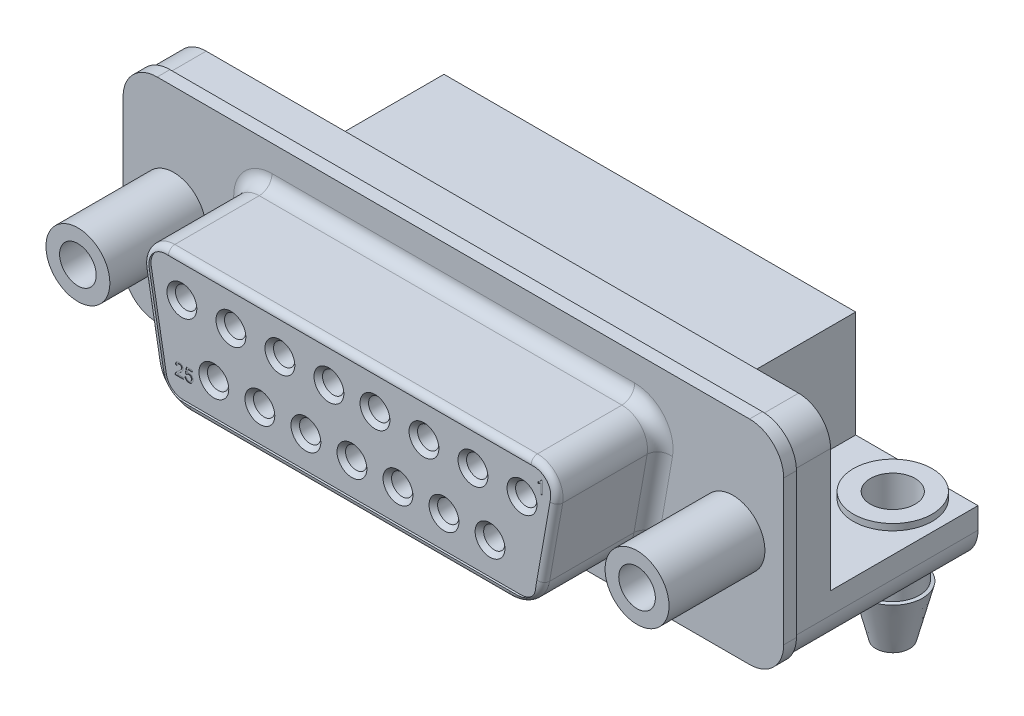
SolidWorks part; units mm, degrees
ref_plane "FRONT" through (0, 0, 0) normal (0, 0, 1) x (1, 0, 0)
ref_plane "TOP" through (0, 0, 0) normal (0, 1, 0) x (1, 0, 0)
ref_plane "RIGHT" through (0, 0, 0) normal (1, 0, 0) x (0, 0, -1)
sketch "Sketch1" plane through (0, 0, 0) normal (0, 0, 1) x (1, 0, 0)
  line L0 (19.685, 0) -> (-19.685, 0) construction
  line L1 (-17.653, -6.3373) -> (17.653, -6.3373)
  line L2 (-19.685, -4.3053) -> (-19.685, 4.3053)
  line L3 (-17.653, 6.3373) -> (17.653, 6.3373)
  line L4 (19.685, -4.3053) -> (19.685, 4.3053)
  line L5 (0, 6.3373) -> (0, -6.3373) construction
  arc A0 (-19.685, -4.3053) -> (-17.653, -6.3373) centre (-17.653, -4.3053) ccw
  arc A1 (-17.653, 6.3373) -> (-19.685, 4.3053) centre (-17.653, 4.3053) ccw
  arc A2 (19.685, 4.3053) -> (17.653, 6.3373) centre (17.653, 4.3053) ccw
  arc A3 (19.685, -4.3053) -> (17.653, -6.3373) centre (17.653, -4.3053) cw
  circle A4 centre (16.6624, 0) radius 1.0922
  circle A5 centre (-16.6624, 0) radius 1.0922
  dimension "D3" = 2.032
  dimension "D4" = 2.1844
  dimension "D5" = 16.6624
  dimension "D1" = 12.6746
  dimension "D2" = 39.37
extrude "Base-Extrude" add sketch "Sketch1" along normal blind 0.762
sketch "Sketch2" plane through (0, 0, 0.762) normal (0, 0, 1) x (1, 0, 0)
  line L0 (0, 6.3373) -> (0, -6.3373) construction
  line L1 (17.653, 6.3373) -> (-17.653, 6.3373) construction
  line L2 (-17.653, -6.3373) -> (17.653, -6.3373) construction
  line L4 (-10.8077, 4.0132) -> (10.8077, 4.0132)
  line L5 (-9.526, -3.8862) -> (9.526, -3.8862)
  line L6 (12.3085, 2.2246) -> (11.5271, -2.2071)
  line L7 (-12.3085, 2.2246) -> (-11.5271, -2.2071)
  arc A0 (12.3085, 2.2246) -> (10.8077, 4.0132) centre (10.8077, 2.4892) ccw
  arc A1 (11.5271, -2.2071) -> (9.526, -3.8862) centre (9.526, -1.8542) cw
  arc A2 (-11.5271, -2.2071) -> (-9.526, -3.8862) centre (-9.526, -1.8542) ccw
  arc A3 (-12.3085, 2.2246) -> (-10.8077, 4.0132) centre (-10.8077, 2.4892) cw
  point P10 (0, 4.0132)
  point P22 (0, -3.8862)
  dimension "D4" = 1.524
  dimension "D5" = 2.032
  dimension "D1" = 24.6634
  dimension "D2" = 100
  dimension "D3" = 7.8994
  dimension "D6" = 2.3241
extrude "Pin  Boss" add sketch "Sketch2" along normal blind 6.1722
fillet "Fillet1" radius 0.762 8 edges at (11.9752, 3.4688, 0.762) (0, 4.0132, 0.762) (-11.9752, 3.4688, 0.762) (-11.9178, 0.0088, 0.762) (-10.8321, -3.4108, 0.762) (0, -3.8862, 0.762) (10.8321, -3.4108, 0.762) (11.9178, 0.0088, 0.762)
fillet "Fillet2" radius 0.381 8 edges at (11.9752, 3.4688, 6.9342) (0, 4.0132, 6.9342) (-11.9752, 3.4688, 6.9342) (-11.9178, 0.0088, 6.9342) (-10.8321, -3.4108, 6.9342) (0, -3.8862, 6.9342) (10.8321, -3.4108, 6.9342) (11.9178, 0.0088, 6.9342)
sketch "Sketch3" plane through (0, 0, 6.9342) normal (0, 0, 1) x (1, 0, 0)
  line L0 (0, 6.3373) -> (0, -6.3373) construction
  line L1 (17.653, 6.3373) -> (-17.653, 6.3373) construction
  line L2 (-17.653, -6.3373) -> (17.653, -6.3373) construction
  line L3 (-10.9591, 3.6322) -> (10.9591, 3.6322)
  line L4 (-10.0588, -3.5052) -> (10.0588, -3.5052)
  line L5 (11.9596, 2.4398) -> (11.0594, -2.6656)
  line L6 (-9.526, -3.5052) -> (9.526, -3.5052) construction
  line L7 (11.1519, -2.1409) -> (11.9333, 2.2907) construction
  line L8 (10.8077, 3.6322) -> (-10.8077, 3.6322) construction
  line L9 (-11.9596, 2.4398) -> (-11.0594, -2.6656)
  arc A0 (11.9596, 2.4398) -> (10.9591, 3.6322) centre (10.9591, 2.6162) ccw
  arc A1 (11.0594, -2.6656) -> (10.0588, -3.5052) centre (10.0588, -2.4892) cw
  arc A2 (-11.0594, -2.6656) -> (-10.0588, -3.5052) centre (-10.0588, -2.4892) ccw
  arc A3 (-11.9596, 2.4398) -> (-10.9591, 3.6322) centre (-10.9591, 2.6162) cw
  point P6 (-10.8077, 3.6322)
  point P9 (0, 3.6322)
  point P15 (10.8077, 3.6322)
  point P28 (0, -3.5052)
  dimension "D2" = 1.016
extrude "Pin Face Releif" cut sketch "Sketch3" against normal blind 0.127
sketch "Sketch5" plane through (0, 0, 0) normal (0, 0, -1) x (-1, 0, 0)
  line L18 (19.558, -4.3053) -> (19.558, 4.3053)
  line L19 (17.653, 6.2103) -> (-17.653, 6.2103)
  line L20 (-19.558, 4.3053) -> (-19.558, -4.3053)
  line L21 (-17.653, -6.2103) -> (17.653, -6.2103)
  line L22 (19.558, -4.3053) -> (19.558, 4.3053)
  line L23 (17.653, 6.2103) -> (-17.653, 6.2103)
  line L24 (-19.558, 4.3053) -> (-19.558, -4.3053)
  line L25 (-17.653, -6.2103) -> (17.653, -6.2103)
  arc A16 (17.653, -6.2103) -> (19.558, -4.3053) centre (17.653, -4.3053) ccw
  arc A17 (19.558, 4.3053) -> (17.653, 6.2103) centre (17.653, 4.3053) ccw
  arc A18 (-17.653, 6.2103) -> (-19.558, 4.3053) centre (-17.653, 4.3053) ccw
  arc A19 (-19.558, -4.3053) -> (-17.653, -6.2103) centre (-17.653, -4.3053) ccw
  arc A20 (17.653, -6.2103) -> (19.558, -4.3053) centre (17.653, -4.3053) ccw
  arc A21 (19.558, 4.3053) -> (17.653, 6.2103) centre (17.653, 4.3053) ccw
  arc A22 (-17.653, 6.2103) -> (-19.558, 4.3053) centre (-17.653, 4.3053) ccw
  arc A23 (-19.558, -4.3053) -> (-17.653, -6.2103) centre (-17.653, -4.3053) ccw
  dimension "D1" = 0.127
extrude "BACKSIDE BOSS" add sketch "Sketch5" along normal offset from surface (2.159 mm away) 2.921
sketch "Sketch7" plane through (0, 0, -2.159) normal (0, 0, -1) x (-1, 0, 0)
  line L0 (17.653, -6.2103) -> (-17.653, -6.2103) construction
  line L1 (17.653, -6.2103) -> (-17.653, -6.2103)
  line L2 (19.558, -3.0353) -> (12.2682, -3.0353)
  line L3 (19.558, 4.3053) -> (19.558, -4.3053) construction
  line L4 (12.2682, -3.0353) -> (12.2682, 3.3147)
  line L5 (12.2682, 3.3147) -> (-12.2682, 3.3147)
  line L6 (0, 0) -> (0, 12.7531) construction
  line L7 (19.558, -3.0353) -> (19.558, -4.3053)
  line L8 (-19.558, -3.0353) -> (-19.558, -4.3053)
  line L13 (-12.2682, -3.0353) -> (-12.2682, 3.3147)
  line L14 (-19.558, -3.0353) -> (-12.2682, -3.0353)
  arc A0 (-19.558, -4.3053) -> (-17.653, -6.2103) centre (-17.653, -4.3053) ccw construction
  arc A1 (17.653, -6.2103) -> (19.558, -4.3053) centre (17.653, -4.3053) ccw construction
  arc A2 (-19.558, -4.3053) -> (-17.653, -6.2103) centre (-17.653, -4.3053) ccw
  arc A3 (17.653, -6.2103) -> (19.558, -4.3053) centre (17.653, -4.3053) ccw
  point P15 (0, 3.3147)
  dimension "D1" = 3.175
  dimension "D2" = 9.525
  dimension "D3" = 24.5364
extrude "backside#2" add sketch "Sketch7" along normal offset from surface (8.7884 mm away) 11.7094
sketch "Sketch10" plane through (0, 0, 6.8072) normal (0, 0, 1) x (1, 0, 0)
  line L0 (0, 0) -> (0, 10.8774) construction
  circle A0 centre (0, -1.6002) radius 0.635
  circle A1 centre (2.7432, -1.6002) radius 0.635
  circle A2 centre (5.4864, -1.6002) radius 0.635
  circle A3 centre (8.2296, -1.6002) radius 0.635
  circle A5 centre (16.4592, -1.6002) radius 0.635
  circle A6 centre (10.9728, -1.6002) radius 0.635
  circle A7 centre (13.716, -1.6002) radius 0.635
  circle A10 centre (-8.2296, -1.6002) radius 0.635
  circle A11 centre (-5.4864, -1.6002) radius 0.635
  circle A12 centre (-2.7432, -1.6002) radius 0.635
  dimension "D1" = 1.6002
  dimension "D3" = 2.7432
  dimension "D2" = 1.27
extrude "bott ROW HOLES" cut sketch "Sketch10" against normal blind 6.35
sketch "Sketch11" plane through (0, 0, 6.8072) normal (0, 0, 1) x (1, 0, 0)
  line L0 (-2.921, 1.5875) -> (0, 1.5875) construction
  line L1 (-1.4605, 1.5875) -> (-1.4605, -3.102) construction
  line L2 (-26.289, 1.5875) -> (-23.368, 1.5875) construction
  line L3 (-24.8285, 1.5875) -> (-24.8285, -1.3335) construction
  line L4 (0, 0) -> (0, -9.5373) construction
  circle A0 centre (-13.0556, 1.6002) radius 0.635
  circle A1 centre (0, 1.5875) radius 0.635 construction
  circle A2 centre (-4.2926, 1.6002) radius 0.635
  circle A3 centre (-7.2136, 1.6002) radius 0.635
  circle A4 centre (-10.1346, 1.6002) radius 0.635
  circle A5 centre (-15.9766, 1.6002) radius 0.635
  circle A7 centre (1.3716, 1.6002) radius 0.635
  circle A10 centre (-1.3716, 1.6002) radius 0.635
  circle A11 centre (10.1346, 1.6002) radius 0.635
  circle A12 centre (7.2136, 1.6002) radius 0.635
  circle A13 centre (4.2926, 1.6002) radius 0.635
  dimension "D1" = 1.6002
  dimension "D2" = 2.7432
extrude "top ROW HOLES" cut sketch "Sketch11" against normal blind 6.35
chamfer "Chamfer2" distance 0.254 angle 45 15 edges at (0.635, -1.6002, 6.8072) (3.3782, -1.6002, 6.8072) (6.1214, -1.6002, 6.8072) (8.8646, -1.6002, 6.8072) (-8.8646, -1.6002, 6.8072) (-6.1214, -1.6002, 6.8072) (-3.3782, -1.6002, 6.8072) (-3.6576, 1.6002, 6.8072) (-6.5786, 1.6002, 6.8072) (-9.4996, 1.6002, 6.8072) (0.7366, 1.6002, 6.8072) (-0.7366, 1.6002, 6.8072) (9.4996, 1.6002, 6.8072) (6.5786, 1.6002, 6.8072) (3.6576, 1.6002, 6.8072)
sketch "Sketch13" plane through (0, -6.2103, 0) normal (0, -1, 0) x (1, 0, 0)
  line L7 (19.685, 0.762) -> (19.685, 0) construction
  line L8 (0, 0) -> (0, -18.529) construction
  line L19 (-8.4502, -8.9827) -> (-7.8152, -8.9827)
  line L20 (-8.4502, -8.9827) -> (-8.4502, -8.3477)
  line L21 (-8.4502, -8.3477) -> (-7.8152, -8.3477)
  line L22 (-7.8152, -8.9827) -> (-7.8152, -8.3477)
  line L23 (-5.7324, -8.9827) -> (-5.0974, -8.9827)
  line L24 (-5.7324, -8.9827) -> (-5.7324, -8.3477)
  line L25 (-5.7324, -8.3477) -> (-5.0974, -8.3477)
  line L26 (-5.0974, -8.9827) -> (-5.0974, -8.3477)
  line L27 (-3.0146, -8.9827) -> (-2.3796, -8.9827)
  line L28 (-3.0146, -8.9827) -> (-3.0146, -8.3477)
  line L29 (-3.0146, -8.3477) -> (-2.3796, -8.3477)
  line L30 (-2.3796, -8.9827) -> (-2.3796, -8.3477)
  line L31 (-0.2968, -8.9827) -> (0.3382, -8.9827)
  line L32 (-0.2968, -8.9827) -> (-0.2968, -8.3477)
  line L33 (-0.2968, -8.3477) -> (0.3382, -8.3477)
  line L34 (0.3382, -8.9827) -> (0.3382, -8.3477)
  line L35 (2.421, -8.9827) -> (3.056, -8.9827)
  line L36 (2.421, -8.9827) -> (2.421, -8.3477)
  line L37 (2.421, -8.3477) -> (3.056, -8.3477)
  line L38 (3.056, -8.9827) -> (3.056, -8.3477)
  line L39 (5.1388, -8.9827) -> (5.7738, -8.9827)
  line L40 (5.1388, -8.9827) -> (5.1388, -8.3477)
  line L41 (5.1388, -8.3477) -> (5.7738, -8.3477)
  line L42 (5.7738, -8.9827) -> (5.7738, -8.3477)
  line L43 (7.8566, -8.9827) -> (8.4916, -8.9827)
  line L44 (7.8566, -8.9827) -> (7.8566, -8.3477)
  line L45 (7.8566, -8.3477) -> (8.4916, -8.3477)
  line L46 (8.4916, -8.9827) -> (8.4916, -8.3477)
  line L93 (-9.8084, -10.0067) -> (-9.1734, -10.0067)
  line L94 (-9.8084, -10.0067) -> (-9.8084, -10.6417)
  line L95 (-9.8084, -10.6417) -> (-9.1734, -10.6417)
  line L96 (-9.1734, -10.0067) -> (-9.1734, -10.6417)
  line L97 (-9.5223, -8.0848) -> (-9.5223, -8.3778) construction
  line L98 (-7.0906, -10.0067) -> (-6.4556, -10.0067)
  line L99 (-7.0906, -10.0067) -> (-7.0906, -10.6417)
  line L100 (-7.0906, -10.6417) -> (-6.4556, -10.6417)
  line L101 (-6.4556, -10.0067) -> (-6.4556, -10.6417)
  line L102 (-6.8045, -8.0848) -> (-6.8045, -8.3778) construction
  line L103 (-4.3728, -10.0067) -> (-3.7378, -10.0067)
  line L104 (-4.3728, -10.0067) -> (-4.3728, -10.6417)
  line L105 (-4.3728, -10.6417) -> (-3.7378, -10.6417)
  line L106 (-3.7378, -10.0067) -> (-3.7378, -10.6417)
  line L107 (-4.0867, -8.0848) -> (-4.0867, -8.3778) construction
  line L108 (-1.655, -10.0067) -> (-1.02, -10.0067)
  line L109 (-1.655, -10.0067) -> (-1.655, -10.6417)
  line L110 (-1.655, -10.6417) -> (-1.02, -10.6417)
  line L111 (-1.02, -10.0067) -> (-1.02, -10.6417)
  line L112 (-1.3689, -8.0848) -> (-1.3689, -8.3778) construction
  line L113 (1.0628, -10.0067) -> (1.6978, -10.0067)
  line L114 (1.0628, -10.0067) -> (1.0628, -10.6417)
  line L115 (1.0628, -10.6417) -> (1.6978, -10.6417)
  line L116 (1.6978, -10.0067) -> (1.6978, -10.6417)
  line L117 (1.3489, -8.0848) -> (1.3489, -8.3778) construction
  line L118 (3.7806, -10.0067) -> (4.4156, -10.0067)
  line L119 (3.7806, -10.0067) -> (3.7806, -10.6417)
  line L120 (3.7806, -10.6417) -> (4.4156, -10.6417)
  line L121 (4.4156, -10.0067) -> (4.4156, -10.6417)
  line L122 (4.0667, -8.0848) -> (4.0667, -8.3778) construction
  line L123 (6.4984, -10.0067) -> (7.1334, -10.0067)
  line L124 (6.4984, -10.0067) -> (6.4984, -10.6417)
  line L125 (6.4984, -10.6417) -> (7.1334, -10.6417)
  line L126 (7.1334, -10.0067) -> (7.1334, -10.6417)
  line L127 (6.7845, -8.0848) -> (6.7845, -8.3778) construction
  line L128 (9.2162, -10.0067) -> (9.8512, -10.0067)
  line L129 (9.2162, -10.0067) -> (9.2162, -10.6417)
  line L130 (9.2162, -10.6417) -> (9.8512, -10.6417)
  line L131 (9.8512, -10.0067) -> (9.8512, -10.6417)
  line L132 (9.5023, -8.0848) -> (9.5023, -8.3778) construction
  line L174 (-25.3418, -10.8204) -> (-24.155, -10.8204) construction
extrude "pins pins pins" add sketch "Sketch13" along normal blind 4.2418
sketch "Sketch15" plane through (0, 0, 0.762) normal (0, 0, 1) x (1, 0, 0)
  circle A0 centre (16.6624, 0) radius 1.905
  circle A1 centre (-16.6624, 0) radius 1.905
  circle A2 centre (-16.6624, 0) radius 1.0922 construction
  circle A3 centre (16.6624, 0) radius 1.0922 construction
  circle A4 centre (-16.6624, 0) radius 1.0922
  circle A5 centre (16.6624, 0) radius 1.0922
  dimension "D1" = 3.81
extrude "Threadedstandoffs" add sketch "Sketch15" along normal blind 5.715
sketch "Sketch16" plane through (0, -3.0353, 0) normal (0, 1, 0) x (-1, 0, 0)
  line L0 (0, -26.406) -> (0, 0) construction
  line L1 (-17.653, 0.762) -> (17.653, 0.762) construction
  circle A0 centre (-16.6624, -8.763) radius 1.5875
  circle A1 centre (16.6624, -8.763) radius 1.5875
  dimension "D1" = 33.3248
  dimension "D2" = 3.175
  dimension "D3" = 9.525
extrude "mount holes" cut sketch "Sketch16" against normal through all
ref_plane "MOUNT BOSS PLANE" through (0, 0, -8.763) normal (0, 0, -1) x (-1, 0, 0)
sketch "Sketch17" plane through (0, 0, -8.763) normal (0, 0, -1) x (-1, 0, 0)
  line L0 (-14.3129, -3.0353) -> (-14.3129, -2.6543)
  line L1 (-19.558, -3.0353) -> (-12.2682, -3.0353) construction
  line L2 (-14.3129, -2.6543) -> (-15.3289, -2.6543)
  line L3 (-14.3129, -3.0353) -> (-15.0749, -3.0353)
  line L4 (-15.0749, -3.0353) -> (-15.0749, -7.2263)
  line L5 (-15.0749, -7.2263) -> (-14.8844, -7.2752)
  line L6 (-14.8844, -7.2752) -> (-15.6544, -10.2743)
  line L7 (-15.6544, -10.2743) -> (-15.9004, -10.2111)
  line L8 (-15.9004, -10.2111) -> (-15.1936, -7.4581)
  line L9 (-15.1936, -7.4581) -> (-15.3289, -7.4233)
  line L10 (-15.3289, -7.4233) -> (-15.3289, -2.6543)
  line L11 (-16.6624, -6.9043) -> (-16.6624, -2.1392) construction
  line L12 (-16.6624, -6.2103) -> (-16.6624, -3.0353) construction
  line L14 (17.653, -6.2103) -> (-17.653, -6.2103) construction
  dimension "D1" = 4.699
  dimension "D2" = 0.381
  dimension "D3" = 0.254
  dimension "D4" = 3.556
  dimension "D5" = 0.254
  dimension "D6" = 0.254
  dimension "D7" = 1.524
  dimension "D8" = 1.016
  dimension "D9" = 4.064
revolve "SNAP IN PEG" add sketch "Sketch17" angle 360 about L11
mirror "Mirror1" about plane through (0, 0, 0) normal (1, 0, 0) of "SNAP IN PEG"
sketch "Sketch18" plane through (0, 0, 6.8072) normal (0, 0, 1) x (1, 0, 0)
  text T0 "1" font "Arial" height 0.762
extrude "1 pin" cut sketch "Sketch18" against normal blind 0.0254
sketch "Sketch19" plane through (0, 0, 6.8072) normal (0, 0, 1) x (1, 0, 0)
  text T0 "25" font "Arial" height 0.762
extrude "15PIN" cut sketch "Sketch19" against normal blind 0.0254
